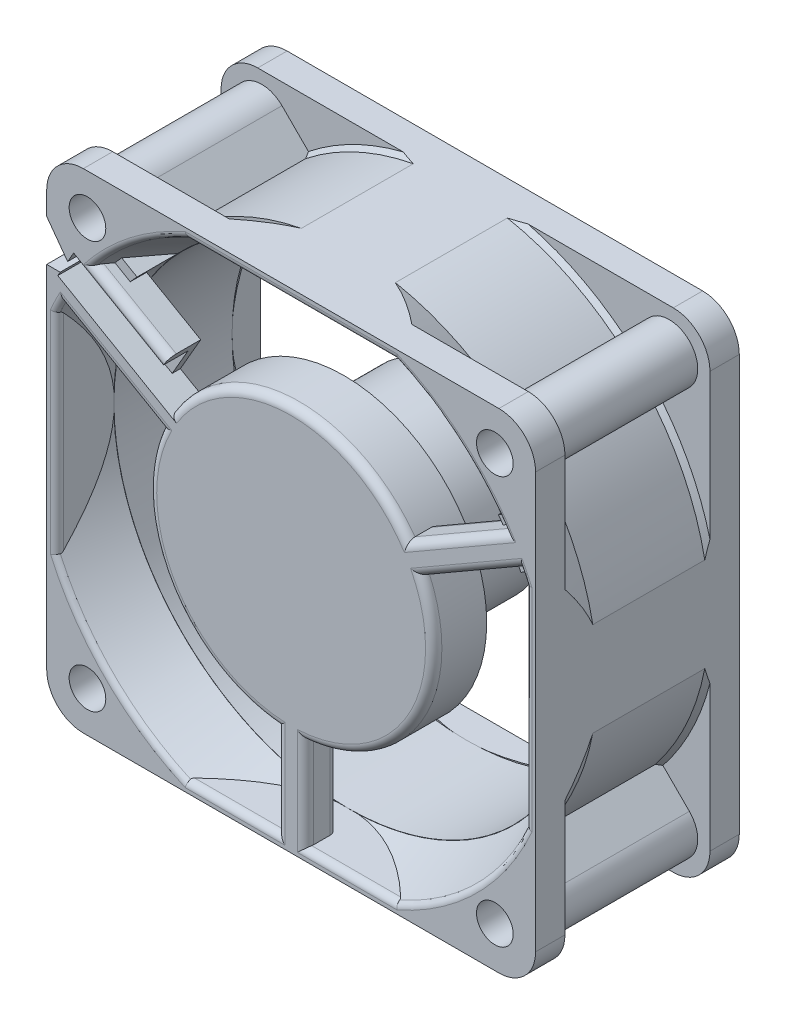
SolidWorks part; units mm, degrees
ref_plane "Alzado" through (0, 0, 0) normal (0, 0, 1) x (1, 0, 0)
ref_plane "Planta" through (0, 0, 0) normal (0, 1, 0) x (1, 0, 0)
ref_plane "Vista lateral" through (0, 0, 0) normal (1, 0, 0) x (0, 0, -1)
sketch "Croquis1" plane through (0, 0, 0) normal (0, 0, 1) x (1, 0, 0)
  line L1 (-25.5, 30) -> (25.5, 30)
  line L2 (-30, 25.5) -> (-30, -25.5)
  line L3 (-25.5, -30) -> (25.5, -30)
  line L4 (30, 25.5) -> (30, -25.5)
  circle A0 centre (0, 0) radius 28.75
  arc A1 (-25.5, 30) -> (-30, 25.5) centre (-25.5, 25.5) ccw
  arc A2 (25.5, 30) -> (30, 25.5) centre (25.5, 25.5) cw
  arc A3 (25.5, -30) -> (30, -25.5) centre (25.5, -25.5) ccw
  arc A4 (-30, -25.5) -> (-25.5, -30) centre (-25.5, -25.5) ccw
  circle A5 centre (-25, 25) radius 2.25
  circle A6 centre (25, 25) radius 2.25
  circle A7 centre (25, -25) radius 2.25
  circle A8 centre (-25, -25) radius 2.25
  point P9 (-30, 30)
  point P12 (30, 30)
  point P17 (-30, -30)
  dimension "D5" = 57.5
  dimension "D6" = 4.5
  dimension "D9" = 4.5
  dimension "D11" = 4.5
  dimension "D13" = 4.5
  dimension "D14" = 4.5
  dimension "D1" = 60
  dimension "D2" = 60
  dimension "D3" = 30
  dimension "D4" = 30
  dimension "D7" = 25
  dimension "D8" = 25
  dimension "D10" = 50
  dimension "D12" = 25
extrude "Extruir1" add sketch "Croquis1" along normal blind 25
sketch "Croquis2" plane through (0, 0, 25) normal (0, 0, 1) x (1, 0, 0)
  line L0 (-13.4722, 28.75) -> (13.4722, 28.75)
  line L1 (28.75, 13.4722) -> (28.75, -13.4722)
  line L2 (-28.75, 13.4722) -> (-28.75, -13.4722)
  line L5 (-13.4722, -28.75) -> (13.4722, -28.75)
  arc A0 (13.4722, -28.75) -> (28.75, -13.4722) centre (0, 0) ccw
  arc A1 (28.75, 13.4722) -> (13.4722, 28.75) centre (0, 0) ccw
  arc A2 (-13.4722, 28.75) -> (-28.75, 13.4722) centre (0, 0) ccw
  arc A3 (-28.75, -13.4722) -> (-13.4722, -28.75) centre (0, 0) ccw
  dimension "D1" = 63.5
extrude "Cortar-Extruir1" cut sketch "Croquis2" against normal blind 7
chamfer "Chaflán1" distance 7 angle 23 4 edges at (-22.4506, -22.4506, 18) (22.4506, -22.4506, 18) (22.4506, 22.4506, 18) (-22.4506, 22.4506, 18)
sketch "Croquis3" plane through (0, 0, 25) normal (0, 0, 1) x (1, 0, 0)
  circle A0 centre (0, 0) radius 17.5
  dimension "D1" = 35
extrude "Extruir2" add sketch "Croquis3" against normal blind 6.5
sketch "Croquis5" plane through (0, -30, 0) normal (0, -1, 0) x (1, 0, 0)
  line L0 (-25.5, 25) -> (25.5, 25) construction
  line L1 (0.75, 25) -> (-0.75, 25)
  line L2 (1.75, 24) -> (1.75, 22)
  line L3 (0.75, 21) -> (-0.75, 21)
  line L4 (-1.75, 24) -> (-1.75, 22)
  arc A0 (0.75, 25) -> (1.75, 24) centre (0.75, 24) cw
  arc A1 (-0.75, 25) -> (-1.75, 24) centre (-0.75, 24) ccw
  arc A2 (1.75, 22) -> (0.75, 21) centre (0.75, 22) cw
  arc A3 (-0.75, 21) -> (-1.75, 22) centre (-0.75, 22) cw
  point P9 (1.75, 25)
  point P12 (-1.75, 25)
  point P15 (1.75, 21)
  dimension "D4" = 1
  dimension "D1" = 3.5
  dimension "D2" = 1.75
  dimension "D3" = 4
extrude "Extruir3" add sketch "Croquis5" against normal blind 14.5 separate body
pattern_circular "MatrizC1" count 3 over 360 about axis through (0, 0, 0) along (0, 0, 1)
sketch "Croquis6" plane through (-25.9808, 15, 0) normal (-0.866, 0.5, 0) x (0, 0, 1)
  line L4 (25, -0.75) -> (25, 0.75)
  line L5 (24, 1.75) -> (22, 1.75)
  line L6 (21, 0.75) -> (21, -0.75)
  line L7 (22, -1.75) -> (24, -1.75)
  line L8 (25, -0.75) -> (25, 0.75)
  line L9 (24, 1.75) -> (22, 1.75)
  line L10 (21, 0.75) -> (21, -0.75)
  line L11 (22, -1.75) -> (24, -1.75)
  arc A4 (24, -1.75) -> (25, -0.75) centre (24, -0.75) ccw
  arc A5 (25, 0.75) -> (24, 1.75) centre (24, 0.75) ccw
  arc A6 (22, 1.75) -> (21, 0.75) centre (22, 0.75) ccw
  arc A7 (21, -0.75) -> (22, -1.75) centre (22, -0.75) ccw
  arc A8 (24, -1.75) -> (25, -0.75) centre (24, -0.75) ccw
  arc A9 (25, 0.75) -> (24, 1.75) centre (24, 0.75) ccw
  arc A10 (22, 1.75) -> (21, 0.75) centre (22, 0.75) ccw
  arc A11 (21, -0.75) -> (22, -1.75) centre (22, -0.75) ccw
  dimension "D1" = 0
extrude "Extruir4" add sketch "Croquis6" along normal blind 2.5 separate body
combine bodies "Combinar1" operation type add bodies to combine 105 107
sketch "Croquis7" plane through (25.9808, 15, 0) normal (0.866, 0.5, 0) x (0, 0, -1)
  line L4 (-25, 0.75) -> (-25, -0.75)
  line L5 (-24, -1.75) -> (-22, -1.75)
  line L6 (-21, -0.75) -> (-21, 0.75)
  line L7 (-22, 1.75) -> (-24, 1.75)
  line L8 (-25, 0.75) -> (-25, -0.75)
  line L9 (-24, -1.75) -> (-22, -1.75)
  line L10 (-21, -0.75) -> (-21, 0.75)
  line L11 (-22, 1.75) -> (-24, 1.75)
  arc A4 (-24, 1.75) -> (-25, 0.75) centre (-24, 0.75) ccw
  arc A5 (-25, -0.75) -> (-24, -1.75) centre (-24, -0.75) ccw
  arc A6 (-22, -1.75) -> (-21, -0.75) centre (-22, -0.75) ccw
  arc A7 (-21, 0.75) -> (-22, 1.75) centre (-22, 0.75) ccw
  arc A8 (-24, 1.75) -> (-25, 0.75) centre (-24, 0.75) ccw
  arc A9 (-25, -0.75) -> (-24, -1.75) centre (-24, -0.75) ccw
  arc A10 (-22, -1.75) -> (-21, -0.75) centre (-22, -0.75) ccw
  arc A11 (-21, 0.75) -> (-22, 1.75) centre (-22, 0.75) ccw
  dimension "D1" = 0
extrude "Extruir5" add sketch "Croquis7" along normal blind 2.5 separate body
sketch "Croquis8" plane through (0, 0, 25) normal (0, 0, 1) x (1, 0, 0)
  line L0 (-12.5241, 7.7504) -> (-30.9764, 18.4038)
  line L2 (-30.9764, 18.4038) -> (-28.2088, 23.1973)
  line L3 (-28.2088, 23.1973) -> (-9.7566, 12.5439)
  line L4 (-9.7566, 12.5439) -> (-12.5241, 7.7504)
  line L6 (-14.2984, 6.2345) -> (-29.0208, 14.7345) construction
  dimension "D1" = 2.2
extrude "Cortar-Extruir2" cut sketch "Croquis8" against normal blind 7.5
sketch "Croquis9" plane through (0, 0, 25) normal (0, 0, 1) x (1, 0, 0)
  line L0 (-17.6004, 10.6812) -> (-15.1004, 15.0113)
  line L1 (-27.9208, 16.6397) -> (-13.1984, 8.1397) construction
  line L2 (-15.1004, 15.0113) -> (-25.4208, 20.9698)
  line L3 (-25.4208, 20.9698) -> (-27.9208, 16.6397)
  line L4 (-27.9208, 16.6397) -> (-17.6004, 10.6812)
  line L5 (-14.2984, 6.2345) -> (-29.0208, 14.7345) construction
  dimension "D1" = 7.2
extrude "Extruir6" add sketch "Croquis9" against normal blind 4 separate body
combine bodies "Combinar2" operation type add bodies to combine 110 111
combine bodies "Combinar3" operation type add bodies to combine 102 103 104 112 106 109
sketch "Croquis11" plane through (0, 0, 25) normal (0, 0, 1) x (1, 0, 0)
  line L1 (-26.6918, 20.4349) -> (-15.3121, 13.8648)
  line L2 (-15.3121, 13.8648) -> (-17.2627, 10.4863)
  line L3 (-17.6004, 10.6812) -> (-14.9254, 9.1368) construction
  line L4 (-17.2627, 10.4863) -> (-28.6425, 17.0563)
  line L5 (-28.6425, 17.0563) -> (-26.6918, 20.4349)
  line L6 (-15.1004, 15.0113) -> (-24.3632, 20.3592) construction
  dimension "D1" = 3.9012
extrude "Cortar-Extruir3" cut sketch "Croquis11" against normal blind 3
fillet "Redondeo1" radius 1 1 edges at (-19.7318, 17.6853, 25)
fillet "Redondeo2" radius 1 3 edges at (-0.1501, 17.4994, 25) (15.1554, -8.75, 25) (-15.1554, -8.75, 25)
fillet "Redondeo3" radius 0.8 11 edges at (28.3203, 14.3535, 25) (28.75, 0, 25) (21.1942, 23.6404, 25) (0, 28.75, 25) (-28.3203, 14.3535, 25) (-19.7758, 24.8391, 25) (22.4506, -22.4506, 25) (7.1111, -28.75, 25) (-7.1111, -28.75, 25) (-22.4506, -22.4506, 25) (-28.75, 0, 25)
ref_plane "Plano1" through (0, 0, 23) normal (0, 0, 1) x (1, 0, 0)
sketch "Croquis12" plane through (0, 0, 23) normal (0, 0, 1) x (1, 0, 0)
  line L0 (23.4427, 16.6929) -> (25.8467, 18.0808)
  line L1 (26.1902, 11.9283) -> (28.5944, 13.3164)
  line L2 (15.9545, 7.1906) -> (27.9613, 14.1228) construction
  line L3 (14.2045, 10.2217) -> (26.2113, 17.1538) construction
  arc A0 (23.4427, 16.6929) -> (26.1902, 11.9283) centre (0, 0) cw
  arc A1 (28.75, 1.2844) -> (1.2844, 28.75) centre (0, 0) ccw construction
  arc A2 (25.8467, 18.0808) -> (28.5944, 13.3164) centre (-7.5243, -4.3394) cw
  arc A3 (26.4773, 17.1441) -> (12.8353, 28.8136) centre (0, 0) ccw construction
  arc A4 (28.8136, 12.8353) -> (28.0859, 14.3579) centre (0, 0) ccw construction
  dimension "D1" = 5.5
extrude "Extruir7" add sketch "Croquis12" against normal blind 6
sketch "Croquis13" plane through (0, 0, 23) normal (0, 0, 1) x (1, 0, 0)
  line L0 (-23.3659, 21.1896) -> (-20.911, 19.7723)
  line L1 (-23.99, 20.1437) -> (-15.1004, 15.0113) construction
  line L2 (-28.606, 13.2915) -> (-26.2016, 11.9033)
  arc A0 (-20.911, 19.7723) -> (-26.2016, 11.9033) centre (0, 0) ccw
  arc A1 (-1.2844, 28.75) -> (-28.75, 1.2844) centre (0, 0) ccw construction
  arc A2 (-23.3659, 21.1896) -> (-28.606, 13.2915) centre (0, 0) ccw
  arc A3 (-12.8353, 28.8136) -> (-24.2732, 20.144) centre (0, 0) ccw construction
  arc A4 (-28.0859, 14.3579) -> (-28.8136, 12.8353) centre (0, 0) ccw construction
extrude "Extruir8" add sketch "Croquis13" against normal blind 6
sketch "Croquis14" plane through (0, 0, 0) normal (0, 0, -1) x (-1, 0, 0)
  line L0 (28.75, -20) -> (28.75, 20)
  line L1 (20, 28.75) -> (-20, 28.75)
  line L2 (-28.75, 20) -> (-28.75, -20)
  line L3 (-20, -28.75) -> (20, -28.75)
  line L4 (21.5, 25) -> (21.5, 27.25)
  line L5 (25, 21.5) -> (27.25, 21.5)
  line L6 (0, 0) -> (0, 24.0409) construction
  line L7 (0, 0) -> (-44.2268, 0) construction
  line L8 (-25, 21.5) -> (-27.25, 21.5)
  line L9 (-21.5, 25) -> (-21.5, 27.25)
  line L10 (25, -21.5) -> (27.25, -21.5)
  line L11 (21.5, -25) -> (21.5, -27.25)
  line L12 (-21.5, -25) -> (-21.5, -27.25)
  line L13 (-25, -21.5) -> (-27.25, -21.5)
  arc A0 (-21.5, 25) -> (-25, 21.5) centre (-25, 25) cw
  arc A1 (21.5, -25) -> (25, -21.5) centre (25, -25) cw
  arc A2 (-21.5, 27.25) -> (-20, 28.75) centre (-20, 27.25) cw
  arc A3 (-27.25, 21.5) -> (-28.75, 20) centre (-27.25, 20) ccw
  arc A4 (21.5, 25) -> (25, 21.5) centre (25, 25) ccw
  arc A5 (-21.5, -25) -> (-25, -21.5) centre (-25, -25) ccw
  arc A6 (-27.25, -21.5) -> (-28.75, -20) centre (-27.25, -20) cw
  arc A7 (-21.5, -27.25) -> (-20, -28.75) centre (-20, -27.25) ccw
  arc A8 (21.5, -27.25) -> (20, -28.75) centre (20, -27.25) cw
  arc A9 (27.25, -21.5) -> (28.75, -20) centre (27.25, -20) ccw
  arc A10 (28.75, 20) -> (27.25, 21.5) centre (27.25, 20) ccw
  arc A11 (20, 28.75) -> (21.5, 27.25) centre (20, 27.25) cw
  point P19 (-21.5, 28.75)
  point P22 (-28.75, 21.5)
  point P37 (-28.75, -21.5)
  point P40 (-21.5, -28.75)
  point P43 (21.5, -28.75)
  point P46 (28.75, -21.5)
  point P49 (28.75, 21.5)
  point P52 (21.5, 28.75)
  dimension "D1" = 7
  dimension "D2" = 1.5
extrude "Cortar-Extruir4" cut sketch "Croquis14" against normal blind 0.5
sketch "Croquis15" plane through (0, 0, 0.5) normal (0, 0, -1) x (-1, 0, 0)
  line L0 (10.1827, 28.75) -> (-10.1827, 28.75)
  line L1 (28.75, 10.1827) -> (28.75, -10.1827)
  line L3 (-10.1827, -28.75) -> (10.1827, -28.75)
  line L4 (-28.75, 10.1827) -> (-28.75, -10.1827)
  arc A0 (-10.1827, 28.75) -> (-28.75, 10.1827) centre (0, 0) ccw
  arc A1 (28.75, 10.1827) -> (10.1827, 28.75) centre (0, 0) ccw
  arc A2 (10.1827, -28.75) -> (28.75, -10.1827) centre (0, 0) ccw
  arc A3 (-28.75, -10.1827) -> (-10.1827, -28.75) centre (0, 0) ccw
  dimension "D1" = 61
extrude "Cortar-Extruir5" cut sketch "Croquis15" against normal blind 3
chamfer "Chaflán2" distance 3 angle 30 4 edges at (-21.5668, -21.5668, 3.5) (21.5668, -21.5668, 3.5) (-21.5668, 21.5668, 3.5) (21.5668, 21.5668, 3.5)
fillet "Redondeo4" radius 0.8 4 edges at (-21.5668, -21.5668, 0.5) (-21.5668, 21.5668, 0.5) (21.5668, 21.5668, 0.5) (21.5668, -21.5668, 0.5)
sketch "Croquis16" plane through (0, 0, 18.5) normal (0, 0, -1) x (-1, 0, 0)
  circle A0 centre (0, 0) radius 11.5753
extrude "Extruir9" add sketch "Croquis16" along normal blind 13
ref_plane "Plano2" through (0, 0, 0) normal (0.7071, 0.7071, 0) x (0, 0, -1)
sketch "Croquis17" plane through (0, 0, 0) normal (0.7071, 0.7071, 0) x (0, 0, -1)
  line L0 (-25, 40.5624) -> (-21.4, 40.5624)
  line L1 (0, 40.5624) -> (-25, 40.5624) construction
  line L2 (-21.4, 40.5624) -> (-21.4, 32.0273)
  line L4 (-21.4, 32.0273) -> (-17.9765, 30.55)
  line L5 (-17.9765, 30.55) -> (-4.2351, 30.55)
  line L6 (-4.2351, 30.55) -> (-3.6, 30.9618)
  line L7 (-3.6, 30.9618) -> (-3.6, 40.5624)
  line L8 (-3.6, 40.5624) -> (0, 40.5624)
  line L9 (0, 40.5624) -> (0, 45.5551)
  line L10 (0, 45.5551) -> (-25, 45.5551)
  line L11 (-25, 45.5551) -> (-25, 40.5624)
  line L12 (0, 0) -> (21.7861, 0) construction
  line L13 (-3.5, 28.75) -> (-18, 28.75) construction
  dimension "D1" = 3.6
  dimension "D2" = 3.6
  dimension "D3" = 1.8
revolve "Cortar-Revolución1" cut sketch "Croquis17" angle 360 about L12
sketch "Croquis18" plane through (0, 0, 3.6) normal (0, 0, 1) x (1, 0, 0)
  line L0 (22.5251, -27.4749) -> (18.5121, -23.4618)
  line L1 (18.5121, -23.4618) -> (23.4618, -18.5121)
  line L2 (23.4618, -18.5121) -> (27.4749, -22.5251)
  line L3 (-25.5, -30) -> (25.5, -30) construction
  circle A0 centre (25, -25) radius 3.5
  dimension "D1" = 7
  dimension "D2" = 45
extrude "Extruir10" add sketch "Croquis18" along normal up to body separate body
pattern_circular "MatrizC2" count 4 over 360 about axis through (0, 0, 0) along (0, 0, 1)
combine bodies "Combinar4" operation type add bodies to combine 122 120 121 123 124
sketch "Croquis19" plane through (-30, 0, 0) normal (-1, 0, 0) x (0, 0, 1)
  line L0 (21.4, -25.5) -> (21.4, -11.2136) construction
  line L1 (3.6, 4.7) -> (21.4, 4.7)
  line L2 (3.6, 4.7) -> (3.6, -4.7)
  line L3 (3.6, -4.7) -> (21.4, -4.7)
  line L4 (21.4, 4.7) -> (21.4, -4.7)
  line L5 (3.6, -7.6572) -> (3.6, -25.5) construction
  line L6 (8.5428, 0.4663) -> (9.3597, 0.4663)
  line L7 (8.5428, 3.5507) -> (6.6734, 3.5507)
  line L8 (8.5428, 3.5507) -> (8.5428, 0.4663)
  line L9 (19.2938, 0.4663) -> (15.596, -1.2975)
  line L10 (6.6734, 3.5507) -> (6.6734, 0.4663)
  line L11 (9.3597, 0.4663) -> (7.596, -3.2315)
  line L12 (7.596, -3.2315) -> (5.8322, 0.4663)
  line L13 (5.8322, 0.4663) -> (6.6734, 0.4663)
  line L14 (15.596, -1.2975) -> (15.596, -0.4562)
  line L15 (15.596, 2.2301) -> (19.2938, 0.4663)
  line L16 (12.5115, 1.4131) -> (12.5115, -0.4562)
  line L17 (12.5115, -0.4562) -> (15.596, -0.4562)
  line L18 (15.596, 1.4131) -> (15.596, 2.2301)
  line L19 (12.5115, 1.4131) -> (15.596, 1.4131)
  dimension "D1" = 9.4
  dimension "D2" = 4.7
  dimension "D3" = 51
  dimension "D4" = 25.5
extrude "Cortar-Extruir6" cut sketch "Croquis19" against normal blind 0.2
sketch "Croquis20" plane through (0, 0, 25) normal (0, 0, 1) x (1, 0, 0)
  line L0 (-28.3483, 17.5658) -> (-31.2192, 17.5658)
  line L1 (-26.6918, 20.4349) -> (-28.6425, 17.0563) construction
  line L2 (-31.2192, 17.5658) -> (-31.2192, 24.3283)
  line L3 (-31.2192, 24.3283) -> (-27.4307, 19.1552)
  line L4 (-26.6918, 20.4349) -> (-28.6425, 17.0563) construction
  line L6 (-27.4307, 19.1552) -> (-25.2291, 17.9478)
  line L7 (-25.2291, 17.9478) -> (-26.3299, 16.2901)
  line L8 (-26.3299, 16.2901) -> (-28.3483, 17.5658)
  arc A0 (-24.2278, 19.2781) -> (-30, 7.6572) centre (0, 0) ccw construction
extrude "Cortar-Extruir7" cut sketch "Croquis20" against normal blind 10.2
sketch "Croquis21" plane through (0, 0, 23) normal (0, 0, 1) x (1, 0, 0)
  line L0 (-26.6918, 20.4349) -> (-22.4609, 17.9922)
  line L1 (-22.4609, 17.9922) -> (-24.695, 14.7773)
  line L2 (-24.695, 14.7773) -> (-28.6425, 17.0563)
  line L3 (-28.6425, 17.0563) -> (-26.6918, 20.4349)
extrude "Cortar-Extruir8" cut sketch "Croquis21" against normal up to surface (1 mm away)
